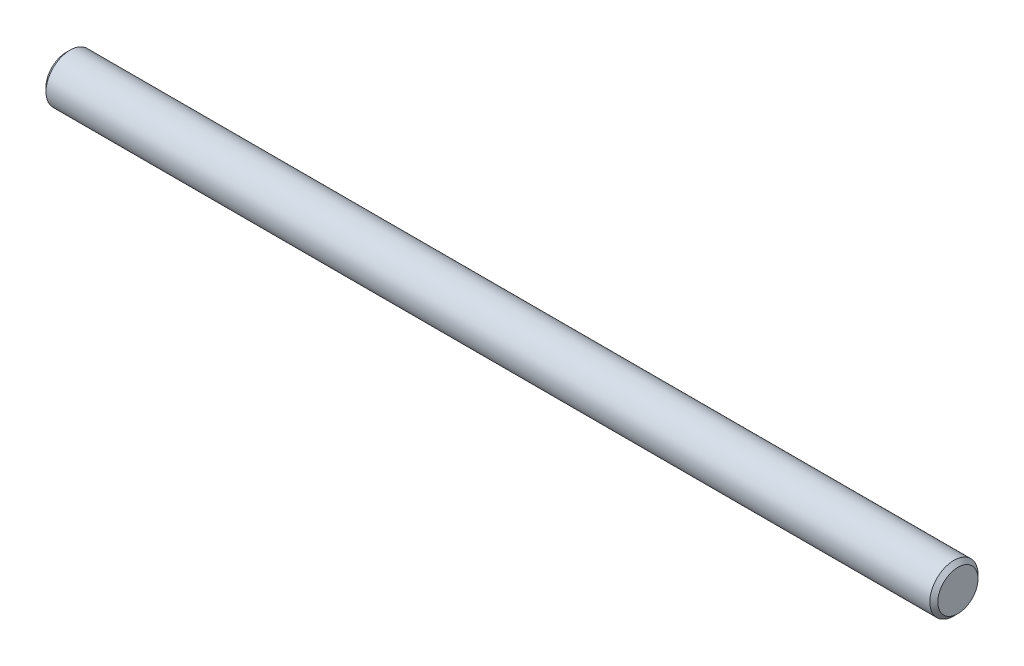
SolidWorks part; units mm, degrees
ref_plane "Front" through (0, 0, 0) normal (0, 0, 1) x (1, 0, 0)
ref_plane "Top" through (0, 0, 0) normal (0, 1, 0) x (1, 0, 0)
ref_plane "Right" through (0, 0, 0) normal (1, 0, 0) x (0, 0, -1)
sketch "Sketch1" plane through (0, 0, 0) normal (1, 0, 0) x (0, 0, -1)
  circle A0 centre (0, 0) radius 6
  dimension "D1" = 12
extrude "Extrude1" add sketch "Sketch1" along normal blind 222
chamfer "Chamfer1" distance 1 angle 45 2 edges at (0, 0, -6) (222, 0, -6)
